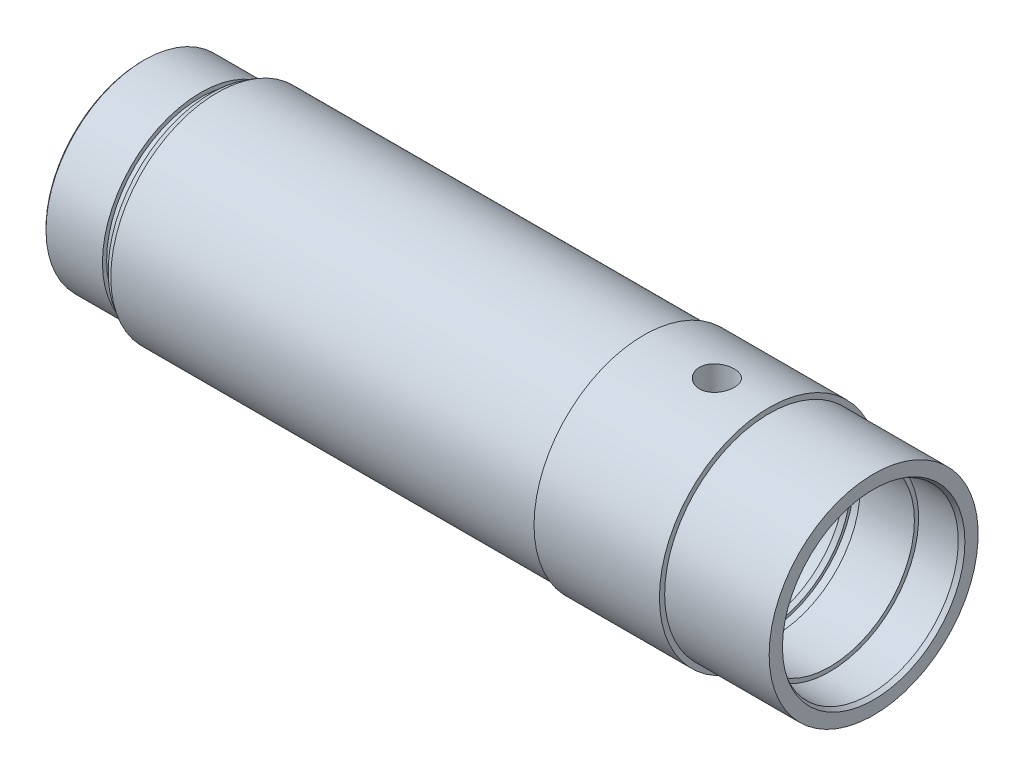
SolidWorks part; units mm, degrees
ref_plane "Plan de face" through (0, 0, 0) normal (0, 0, 1) x (1, 0, 0)
ref_plane "Plan de dessus" through (0, 0, 0) normal (0, 1, 0) x (1, 0, 0)
ref_plane "Plan de droite" through (0, 0, 0) normal (1, 0, 0) x (0, 0, -1)
sketch "Esquisse1" plane through (0, 0, 0) normal (0, 0, 1) x (1, 0, 0)
  line L0 (0, 0) -> (360.2003, 0) construction
  line L1 (0, -7.5641) -> (0, 28.9101) construction
  line L2 (0, 40) -> (298, 40)
  line L4 (298, 40) -> (298, 42.5)
  line L5 (298, 42.5) -> (303, 42.5)
  line L6 (303, 42.5) -> (303, 40.5)
  line L7 (303, 40.5) -> (329, 40.5)
  line L8 (329, 40.5) -> (329, 42.5)
  line L9 (329, 42.5) -> (350, 42.5)
  line L11 (350, 42.5) -> (350, 50)
  line L12 (350, 50) -> (300, 50)
  line L13 (300, 50) -> (300, 52.5)
  line L14 (300, 52.5) -> (240, 52.5)
  line L15 (240, 52.5) -> (240, 51)
  line L16 (240, 51) -> (33, 51)
  line L18 (33, 51) -> (33, 45)
  line L19 (33, 45) -> (28, 45)
  line L20 (28, 45) -> (28, 47)
  line L21 (28, 47) -> (0, 47)
  line L22 (0, 47) -> (0, 40)
  dimension "D1" = 102
  dimension "D2" = 105
  dimension "D3" = 350
  dimension "D4" = 33
  dimension "D5" = 94
  dimension "D6" = 90
  dimension "D7" = 5
  dimension "D8" = 80
  dimension "D9" = 240
  dimension "D10" = 50
  dimension "D11" = 100
  dimension "D12" = 47
  dimension "D13" = 85
  dimension "D14" = 5
  dimension "D15" = 81
  dimension "D16" = 21
  dimension "D17" = 85
revolve "Révolution1" add sketch "Esquisse1" angle 360 about L0
sketch "Esquisse3" plane through (0, 0, 0) normal (0, 1, 0) x (1, 0, 0)
  line L0 (350, 0) -> (126.8786, 0) construction
  line L1 (350, -50) -> (350, 50) construction
  circle A0 centre (275, 0) radius 8.331
  point P5 (275, 0)
  dimension "D2" = 16.662
  dimension "D1" = 75
extrude "Extrusion1" cut sketch "Esquisse3" along normal blind 87
chamfer "Chanfrein1" distance 1 angle 45 1 edges at (0, 0, 47)
chamfer "Chanfrein2" distance 3 angle 30 1 edges at (33, 0, 51)
chamfer "Chanfrein3" distance 2 angle 30 2 edges at (298, 0, 40) (350, 0, 42.5)
